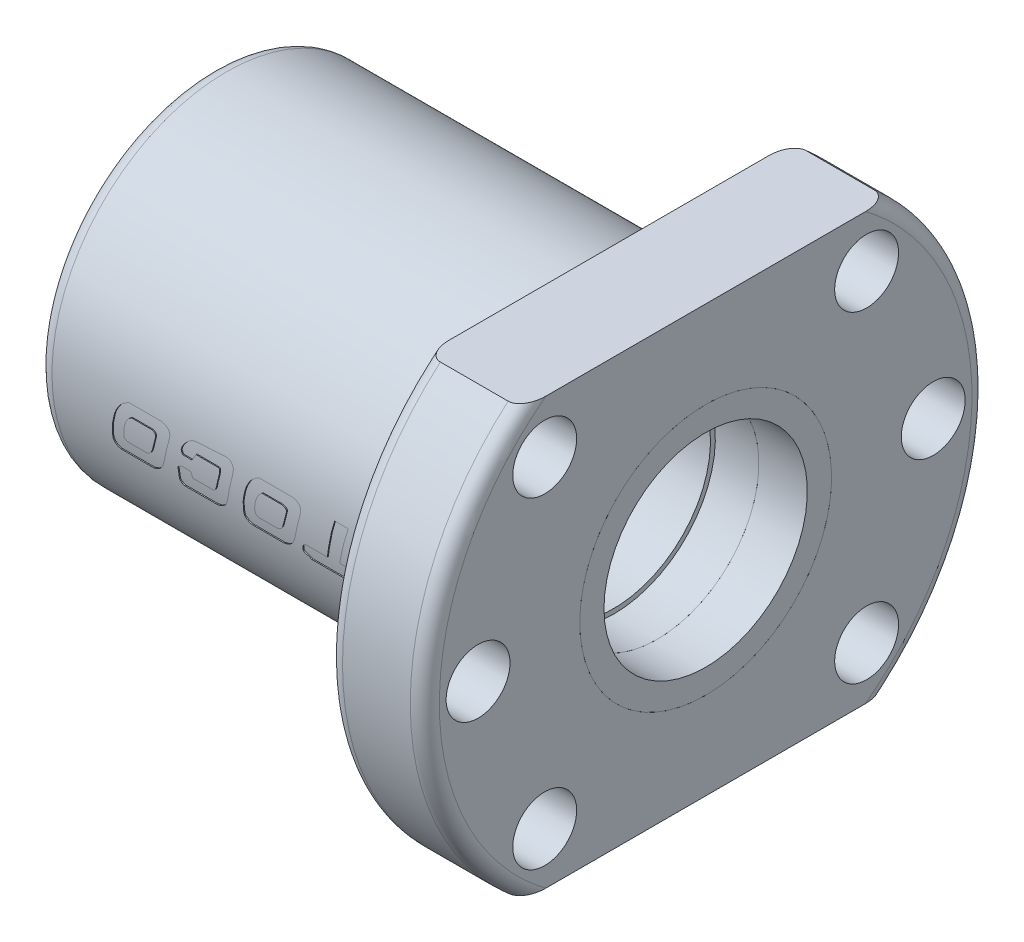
SolidWorks part; units mm, degrees
other "____1[1]"
ref_plane "Front Plane" through (0, 0, 0) normal (0, 0, 1) x (1, 0, 0)
ref_plane "Top Plane" through (0, 0, 0) normal (0, 1, 0) x (1, 0, 0)
ref_plane "Right Plane" through (0, 0, 0) normal (1, 0, 0) x (0, 0, -1)
imported_body "Imported1"
imported_body "Imported2"
sketch "Sketch1" plane through (0, 0, 0) normal (1, 0, 0) x (0, 0, -1)
  circle A0 centre (0, 0) radius 10
extrude "Cut-Extrude1" cut sketch "Sketch1" against normal up to surface (82 mm away)
